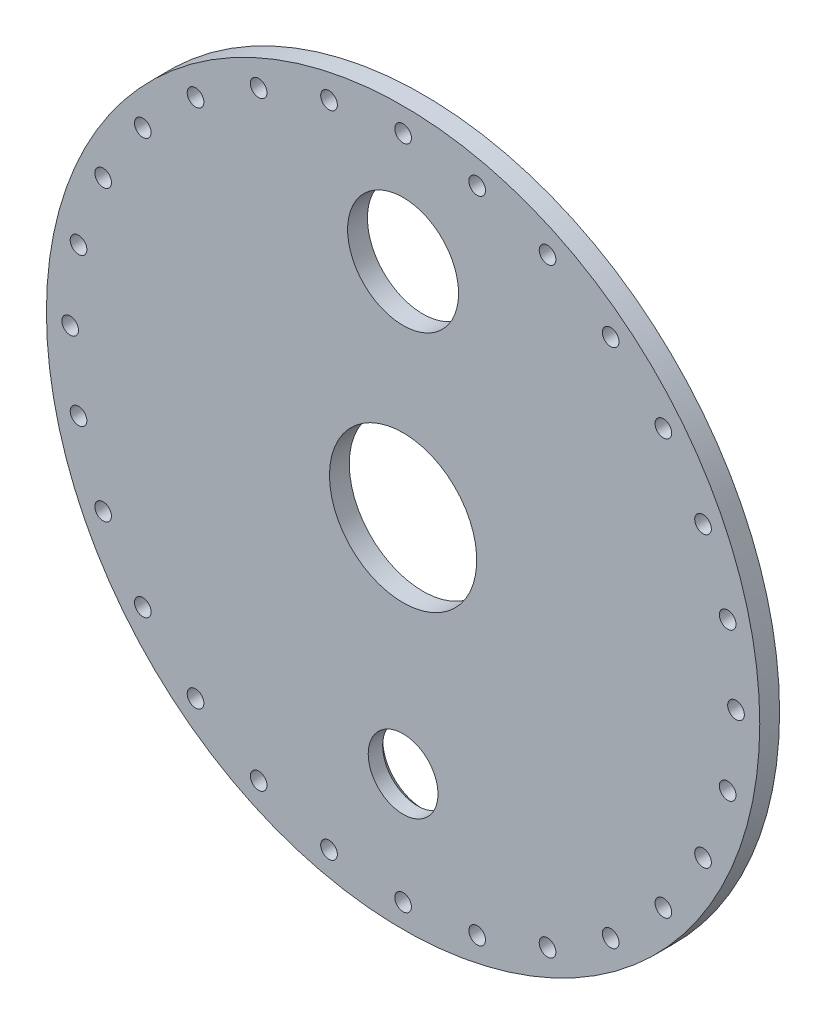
SolidWorks part; units mm, degrees
ref_plane "Alzado" through (0, 0, 0) normal (0, 0, 1) x (1, 0, 0)
ref_plane "Planta" through (0, 0, 0) normal (0, 1, 0) x (1, 0, 0)
ref_plane "Vista lateral" through (0, 0, 0) normal (1, 0, 0) x (0, 0, -1)
sketch "Croquis1" plane through (0, 0, 0) normal (0, 0, 1) x (1, 0, 0)
  circle A0 centre (0, 0) radius 225
extrude "Saliente-Extruir1" add sketch "Croquis1" along normal blind 12.5
sketch "Croquis3" plane through (0, 0, 12.5) normal (0, 0, 1) x (1, 0, 0)
  circle A0 centre (0, 210) radius 5.25
  dimension "D1" = 210
extrude "Cortar-Extruir4" cut sketch "Croquis3" against normal blind 12.5
pattern_circular "MatrizC1" count 28 over 360 about axis through (0, 0, 0) along (0, 0, 1) of "Cortar-Extruir4"
sketch "Croquis4" plane through (0, 0, 12.5) normal (0, 0, 1) x (1, 0, 0)
  circle A0 centre (0, 140) radius 35
  circle A1 centre (0, 0) radius 225
  circle A2 centre (0, 0) radius 225
  circle A3 centre (0, -140) radius 22
  dimension "D1" = 0
sketch "Croquis6" plane through (0, 0, 12.5) normal (0, 0, 1) x (1, 0, 0)
  line L0 (0, 210) -> (0, -212.9552) construction
  circle A0 centre (0, 140) radius 35
  dimension "D3" = 70
  dimension "D2" = 140
extrude "Cortar-Extruir11" cut sketch "Croquis6" against normal blind 12.5
hole_wizard "Refrentado para tornillo tapón con cabeza plana de clavija de M205" positions "Croquis3D4" profile "Croquis46" countersink size "M20" standard "Métrico Ansi"
sketch3d "Croquis3D4"
  point P1 (0, -140, 0)
  dimension "D1" = 140
sketch "Croquis46" plane through (0, -140, 0) normal (1, 0, 0) x (0, 1, 0)
  line L0 (0, 0) -> (0, 12.5)
  line L1 (0, 12.5) -> (22, 12.5)
  line L2 (22, 12.5) -> (22, 3.4)
  line L3 (22, 3.4) -> (25.4, 0)
  line L5 (25.4, 0) -> (0, 0)
  line L6 (-22, 3.4) -> (-25.4, 0) construction
  line L11 (0, -6.35) -> (0, 107.95) construction
  dimension "Diámetro de taladro hasta el siguiente" = 44
  dimension "Profundidad de taladro hasta el siguiente" = 12.5
  dimension "Diámetro de avellanado cercano" = 50.8
  dimension "Ángulo de avellanado cercano" = 90
sketch "Croquis48" plane through (0, 0, 0) normal (0, 0, -1) x (-1, 0, 0)
  circle A0 centre (0, 0) radius 46.45
  dimension "D1" = 92.9
extrude "Cortar-Extruir13" cut sketch "Croquis48" against normal through all
